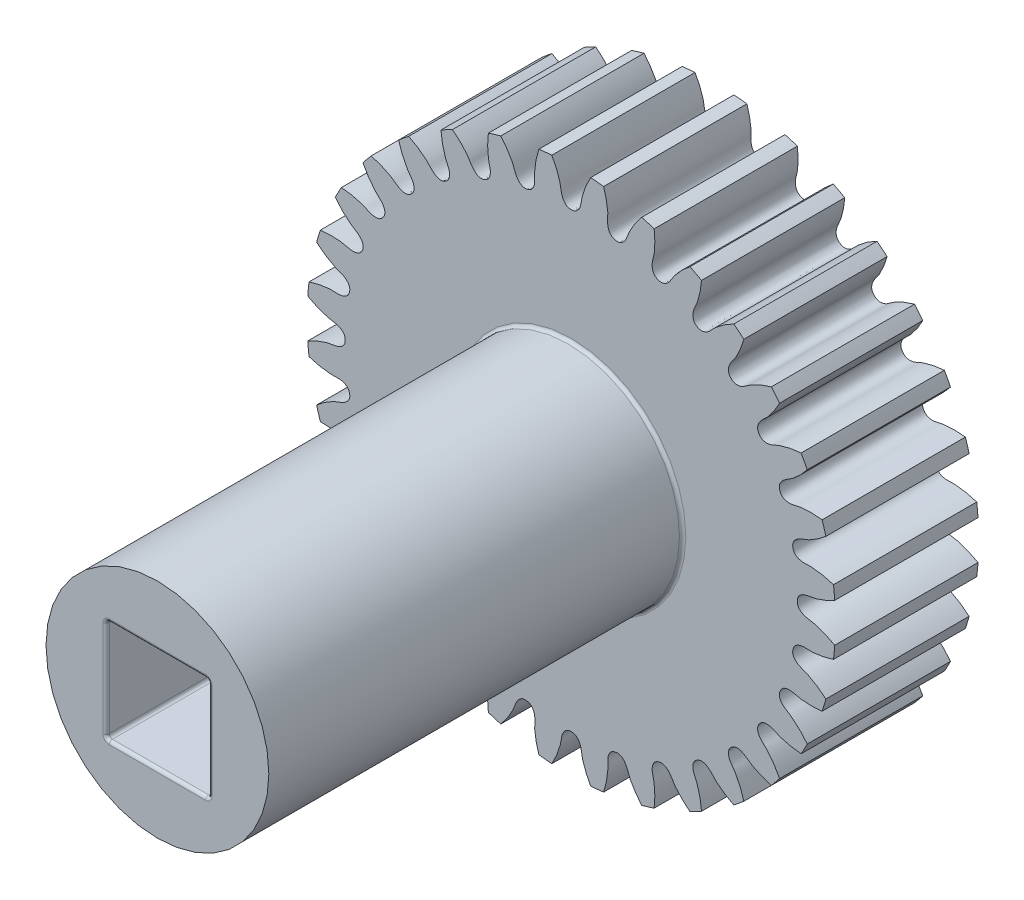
SolidWorks part; units mm, degrees
ref_plane "Front Plane" through (0, 0, 0) normal (0, 0, 1) x (1, 0, 0)
ref_plane "Top Plane" through (0, 0, 0) normal (0, 1, 0) x (1, 0, 0)
ref_plane "Right Plane" through (0, 0, 0) normal (1, 0, 0) x (0, 0, -1)
ref_plane "Plane1" through (0, 0, 2.25) normal (0, 0, 1) x (1, 0, 0)
sketch "Sketch1" plane through (0, 0, 2.25) normal (0, 0, 1) x (1, 0, 0)
  arc A0 (8.2776, 0.61) -> (8.2375, 1.0166) centre (0, 0) ccw
  arc A1 (7.9995, 2.2131) -> (7.8809, 2.6041) centre (0, 0) ccw
  arc A2 (7.414, 3.7312) -> (7.2214, 4.0916) centre (0, 0) ccw
  arc A3 (6.5437, 5.1059) -> (6.2844, 5.4218) centre (0, 0) ccw
  arc A4 (5.4218, 6.2844) -> (5.1059, 6.5437) centre (0, 0) ccw
  arc A5 (4.0916, 7.2214) -> (3.7312, 7.414) centre (0, 0) ccw
  arc A6 (2.6041, 7.8809) -> (2.2131, 7.9995) centre (0, 0) ccw
  arc A7 (1.0166, 8.2375) -> (0.61, 8.2776) centre (0, 0) ccw
  arc A8 (-0.61, 8.2776) -> (-1.0166, 8.2375) centre (0, 0) ccw
  arc A9 (-2.2131, 7.9995) -> (-2.6041, 7.8809) centre (0, 0) ccw
  arc A10 (-3.7312, 7.414) -> (-4.0916, 7.2214) centre (0, 0) ccw
  arc A11 (-5.1059, 6.5437) -> (-5.4218, 6.2844) centre (0, 0) ccw
  arc A12 (-6.2844, 5.4218) -> (-6.5437, 5.1059) centre (0, 0) ccw
  arc A13 (-7.2214, 4.0916) -> (-7.414, 3.7312) centre (0, 0) ccw
  arc A14 (-7.8809, 2.6041) -> (-7.9995, 2.2131) centre (0, 0) ccw
  arc A15 (-8.2375, 1.0166) -> (-8.2776, 0.61) centre (0, 0) ccw
  arc A16 (-8.2776, -0.61) -> (-8.2375, -1.0166) centre (0, 0) ccw
  arc A17 (-7.9995, -2.2131) -> (-7.8809, -2.6041) centre (0, 0) ccw
  arc A18 (-7.414, -3.7312) -> (-7.2214, -4.0916) centre (0, 0) ccw
  arc A19 (-6.5437, -5.1059) -> (-6.2844, -5.4218) centre (0, 0) ccw
  arc A20 (-5.4218, -6.2844) -> (-5.1059, -6.5437) centre (0, 0) ccw
  arc A21 (-4.0916, -7.2214) -> (-3.7312, -7.414) centre (0, 0) ccw
  arc A22 (-2.6041, -7.8809) -> (-2.2131, -7.9995) centre (0, 0) ccw
  arc A23 (-1.0166, -8.2375) -> (-0.61, -8.2776) centre (0, 0) ccw
  arc A24 (0.61, -8.2776) -> (1.0166, -8.2375) centre (0, 0) ccw
  arc A25 (2.2131, -7.9995) -> (2.6041, -7.8809) centre (0, 0) ccw
  arc A26 (3.7312, -7.414) -> (4.0916, -7.2214) centre (0, 0) ccw
  arc A27 (5.1059, -6.5437) -> (5.4218, -6.2844) centre (0, 0) ccw
  arc A28 (6.2844, -5.4218) -> (6.5437, -5.1059) centre (0, 0) ccw
  arc A29 (7.2214, -4.0916) -> (7.414, -3.7312) centre (0, 0) ccw
  arc A30 (7.8809, -2.6041) -> (7.9995, -2.2131) centre (0, 0) ccw
  arc A31 (8.2375, -1.0166) -> (8.2776, -0.61) centre (0, 0) ccw
  spline S0 degree 3 number of poles 193 (8.2776, 0.61) -> (8.2776, -0.61)
  spline S1 degree 3 number of poles 193 (7.9995, 2.2131) -> (8.2375, 1.0166)
  spline S2 degree 3 number of poles 193 (7.414, 3.7312) -> (7.8809, 2.6041)
  spline S3 degree 3 number of poles 193 (6.5437, 5.1059) -> (7.2214, 4.0916)
  spline S4 degree 3 number of poles 193 (5.4218, 6.2844) -> (6.2844, 5.4218)
  spline S5 degree 3 number of poles 193 (4.0916, 7.2214) -> (5.1059, 6.5437)
  spline S6 degree 3 number of poles 193 (2.6041, 7.8809) -> (3.7312, 7.414)
  spline S7 degree 3 number of poles 193 (1.0166, 8.2375) -> (2.2131, 7.9995)
  spline S8 degree 3 number of poles 193 (-0.61, 8.2776) -> (0.61, 8.2776)
  spline S9 degree 3 number of poles 193 (-2.2131, 7.9995) -> (-1.0166, 8.2375)
  spline S10 degree 3 number of poles 193 (-3.7312, 7.414) -> (-2.6041, 7.8809)
  spline S11 degree 3 number of poles 193 (-5.1059, 6.5437) -> (-4.0916, 7.2214)
  spline S12 degree 3 number of poles 193 (-6.2844, 5.4218) -> (-5.4218, 6.2844)
  spline S13 degree 3 number of poles 193 (-7.2214, 4.0916) -> (-6.5437, 5.1059)
  spline S14 degree 3 number of poles 193 (-7.8809, 2.6041) -> (-7.414, 3.7312)
  spline S15 degree 3 number of poles 193 (-8.2375, 1.0166) -> (-7.9995, 2.2131)
  spline S16 degree 3 number of poles 193 (-8.2776, -0.61) -> (-8.2776, 0.61)
  spline S17 degree 3 number of poles 193 (-7.9995, -2.2131) -> (-8.2375, -1.0166)
  spline S18 degree 3 number of poles 193 (-7.414, -3.7312) -> (-7.8809, -2.6041)
  spline S19 degree 3 number of poles 193 (-6.5437, -5.1059) -> (-7.2214, -4.0916)
  spline S20 degree 3 number of poles 193 (-5.4218, -6.2844) -> (-6.2844, -5.4218)
  spline S21 degree 3 number of poles 193 (-4.0916, -7.2214) -> (-5.1059, -6.5437)
  spline S22 degree 3 number of poles 193 (-2.6041, -7.8809) -> (-3.7312, -7.414)
  spline S23 degree 3 number of poles 193 (-1.0166, -8.2375) -> (-2.2131, -7.9995)
  spline S24 degree 3 number of poles 193 (0.61, -8.2776) -> (-0.61, -8.2776)
  spline S25 degree 3 number of poles 193 (2.2131, -7.9995) -> (1.0166, -8.2375)
  spline S26 degree 3 number of poles 193 (3.7312, -7.414) -> (2.6041, -7.8809)
  spline S27 degree 3 number of poles 193 (5.1059, -6.5437) -> (4.0916, -7.2214)
  spline S28 degree 3 number of poles 193 (6.2844, -5.4218) -> (5.4218, -6.2844)
  spline S29 degree 3 number of poles 193 (7.2214, -4.0916) -> (6.5437, -5.1059)
  spline S30 degree 3 number of poles 193 (7.8809, -2.6041) -> (7.414, -3.7312)
  spline S31 degree 3 number of poles 193 (8.2375, -1.0166) -> (7.9995, -2.2131)
extrude "Boss-Extrude1" add sketch "Sketch1" against normal blind 4.5
sketch "Sketch2" plane through (0, 0, 2.25) normal (0, 0, 1) x (1, 0, 0)
  circle A0 centre (0, 0) radius 3.5
extrude "Boss-Extrude2" add sketch "Sketch2" along normal blind 13
sketch "Sketch3" plane through (0, 0, 15.25) normal (0, 0, 1) x (1, 0, 0)
  line L0 (1.6129, 1.6129) -> (-1.6129, 1.6129)
  line L1 (-1.6129, 1.6129) -> (-1.6129, -1.6129)
  line L2 (-1.6129, -1.6129) -> (1.6129, -1.6129)
  line L3 (1.6129, -1.6129) -> (1.6129, 1.6129)
extrude "Cut-Extrude1" cut sketch "Sketch3" against normal blind 7.5
hole_wizard "CBORE for #1 Binding Head Machine Screw1" positions "Sketch5" profile "Sketch4" counterbore size "#1" standard "ANSI Inch"
sketch "Sketch5" plane through (0, 0, -2.25) normal (0, 0, -1) x (-1, 0, 0)
  point P0 (0, 0)
sketch "Sketch4" plane through (0, 0, -2.25) normal (1, 0, 0) x (0, 1, 0)
  line L0 (0, 0) -> (0, 17.5)
  line L1 (0, 17.5) -> (1.025, 17.5)
  line L3 (1.025, 17.5) -> (1.025, 2.3)
  line L4 (1.025, 2.3) -> (3.05, 2.3)
  line L5 (3.05, 2.3) -> (3.05, 0)
  line L7 (3.05, 0) -> (0, 0)
  line L11 (0, -6.35) -> (0, 107.95) construction
  dimension "Thru Hole Dia." = 2.05
  dimension "Thru Hole Depth" = 17.5
  dimension "C'Bore Dia." = 6.1
  dimension "C'Bore Depth" = 2.3
fillet "Fillet1" radius 0.1 13 edges at (1.6129, 0, 15.25) (0, -1.6129, 15.25) (0, 1.6129, 15.25) (-1.6129, 0, 15.25) (3.5, 0, 2.25) (-1.6129, 1.6129, 11.5) (0, 1.6129, 7.75) (1.6129, 1.6129, 11.5) (-1.6129, -1.6129, 11.5) (1.6129, -1.6129, 11.5) (-1.6129, 0, 7.75) (1.6129, 0, 7.75) (0, -1.6129, 7.75)
